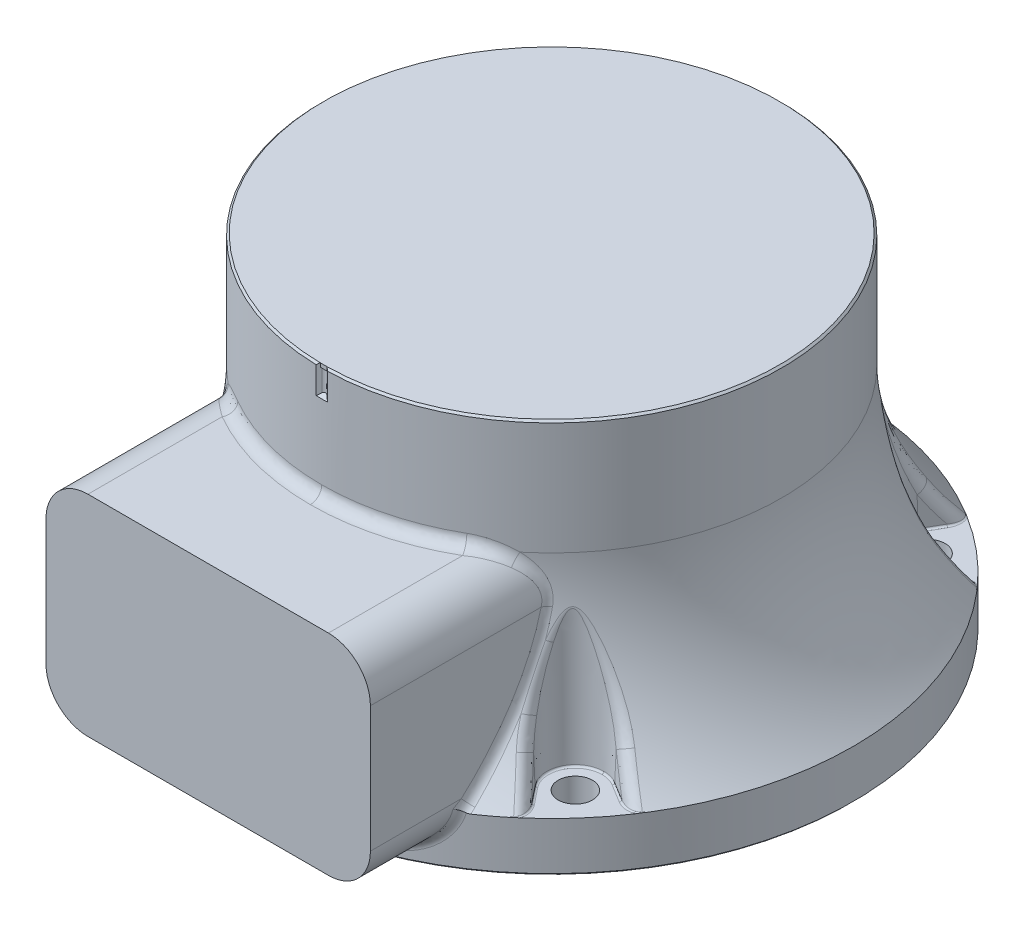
SolidWorks part; units mm, degrees
ref_plane "前视基准面" through (0, 0, 0) normal (0, 0, 1) x (1, 0, 0)
ref_plane "上视基准面" through (0, 0, 0) normal (0, 1, 0) x (1, 0, 0)
ref_plane "右视基准面" through (0, 0, 0) normal (1, 0, 0) x (0, 0, -1)
imported_body "输入1"
delete or keep bodies "实体-删除/保留 1" type keep bodies bodies 109
